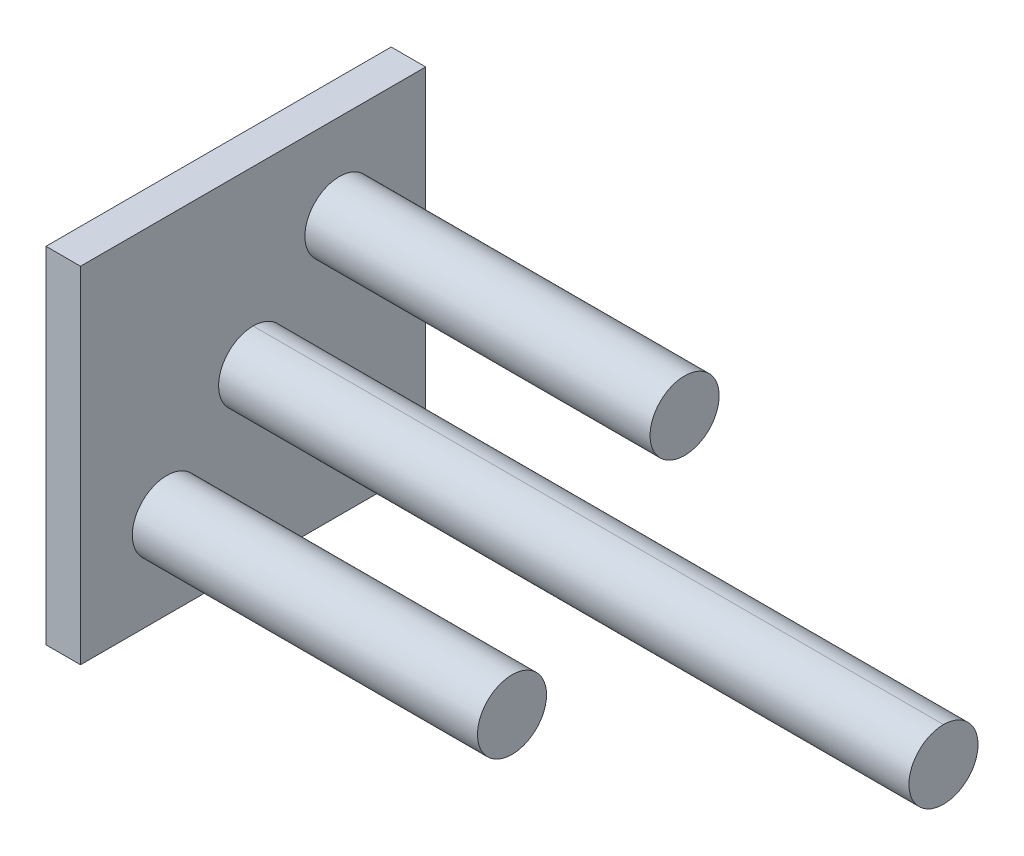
SolidWorks part; units mm, degrees
ref_plane "Front"
ref_plane "Top" through (0, 0, 0) normal (0, 1, 0) x (1, 0, 0)
ref_plane "Right" through (0, 0, 0) normal (1, 0, 0) x (0, 0, -1)
sketch "Sketch1" plane through (0, 0, 0) normal (1, 0, 0) x (0, 0, -1)
  line L0 (-10, 10) -> (10, 10)
  line L1 (10, 10) -> (10, -10)
  line L2 (10, -10) -> (-10, -10)
  line L3 (-10, -10) -> (-10, 10)
  dimension "D1" = 20
  dimension "D2" = 20
  dimension "D3" = 10
  dimension "D4" = 10
extrude "Boss-Extrude1" add sketch "Sketch1" along normal blind 2
sketch "Sketch2" plane through (2, 0, 0) normal (1, 0, 0) x (0, 0, -1)
  line L0 (10, 10) -> (-10, 10) construction
  line L1 (-10, 10) -> (-10, -10) construction
  circle A4 centre (0, 0) radius 2
  dimension "D1" = 4
  dimension "D2" = 10
  dimension "D12" = 10
extrude "Boss-Extrude2" add sketch "Sketch2" along normal blind 40 separate body
sketch "Sketch4" plane through (0, 0, 0) normal (0, 0, 1) x (1, 0, 0)
  line L0 (2, 0) -> (42, 0)
  line L1 (2, 10) -> (2, -10) construction
  line L2 (42, -2) -> (42, 2) construction
sketch "Sketch5" [suppressed] plane through (2, 0, 0) normal (1, 0, 0) x (0, 0, -1)
  line L0 (-2, 0) -> (2, 0)
  arc A0 (-2, 0) -> (2, 0) centre (0, 0) cw
  point P4 (0, 0)
  dimension "D1" = 4
extrude "Boss-Extrude3" [suppressed] add sketch "Sketch5" along normal blind 40
sketch "Sketch6" [suppressed] plane through (0, 0, 0) normal (0, -1, 0) x (1, 0, 0)
  line L0 (2, 0) -> (42, 0)
  line L1 (2, 2) -> (2, -2) construction
  line L2 (42, 2) -> (42, -2) construction
